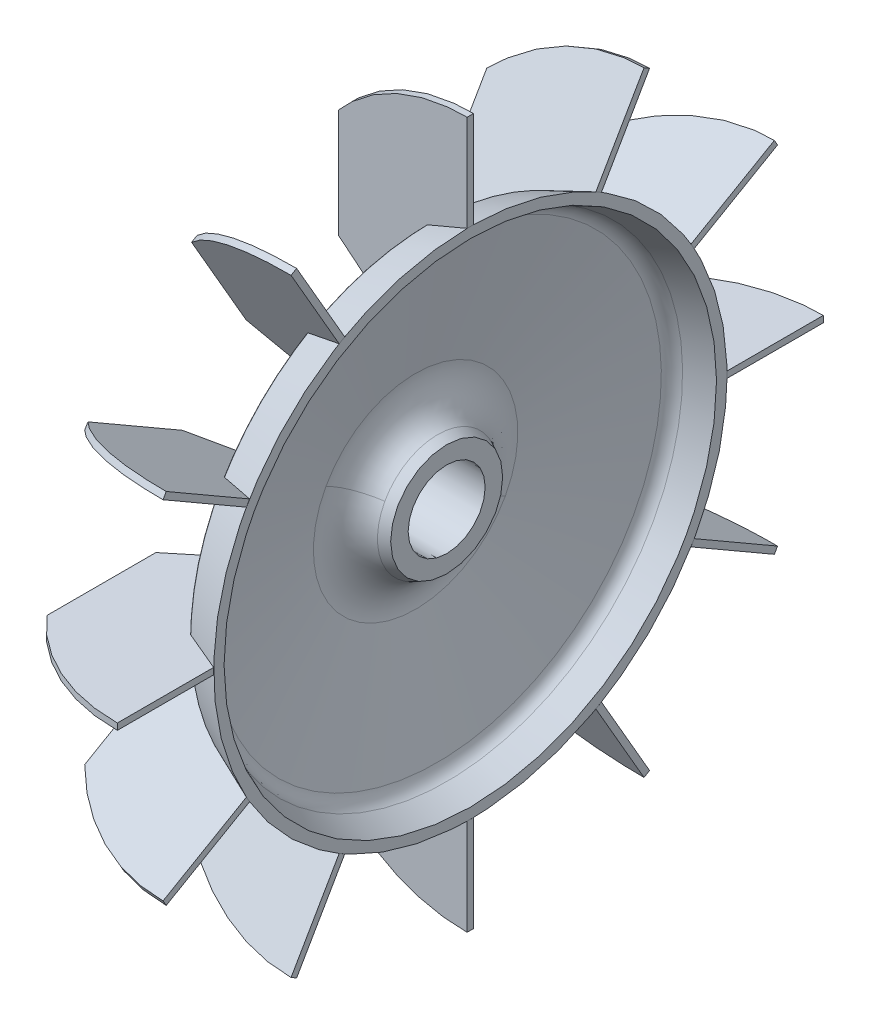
SolidWorks part; units mm, degrees
ref_plane "Plan de face" through (0, 0, 0) normal (0, 0, 1) x (1, 0, 0)
ref_plane "Plan de dessus" through (0, 0, 0) normal (0, 1, 0) x (1, 0, 0)
ref_plane "Plan de droite" through (0, 0, 0) normal (1, 0, 0) x (0, 0, -1)
imported_body "Importée3"
sketch "Esquisse1" plane through (-18, 0, 0) normal (-1, 0, 0) x (0, 0, 1)
  circle A0 centre (0, 0) radius 6.5
  circle A1 centre (0, 0) radius 6
  dimension "D1" = 13
  dimension "D2" = 12
extrude "Boss.-Extru.1" add sketch "Esquisse1" against normal up to surface (14.316 mm away)
